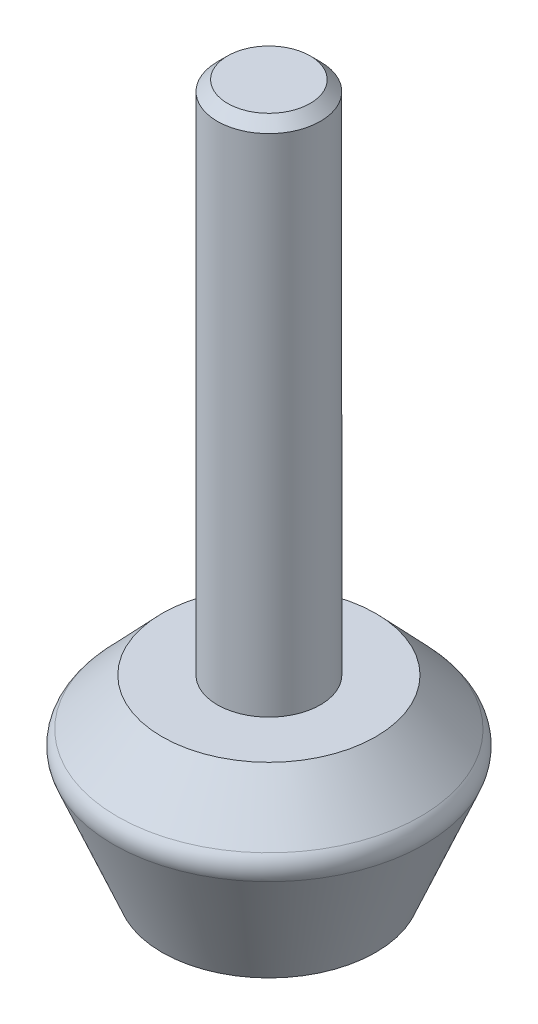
SolidWorks part; units mm, degrees
ref_plane "Frontal" through (0, 0, 0) normal (0, 0, 1) x (1, 0, 0)
ref_plane "Horizontal" through (0, 0, 0) normal (0, 1, 0) x (1, 0, 0)
ref_plane "Vertical" through (0, 0, 0) normal (1, 0, 0) x (0, 0, -1)
sketch "Esquisse1" plane through (0, 0, 0) normal (0, 0, 1) x (1, 0, 0)
  line L0 (0, 60.9391) -> (0, -10.3481) construction
  line L1 (0, 0) -> (5.1812, 0)
  line L2 (5.1812, 0) -> (7.7913, 6.3132)
  line L3 (7.7913, 6.3132) -> (5.1812, 9.055)
  line L4 (5.1812, 9.055) -> (2.5, 9.055)
  line L5 (2.5, 9.055) -> (2.5, 34.055)
  line L6 (2.5, 34.055) -> (0, 34.055)
  line L7 (0, 34.055) -> (0, 0)
  dimension "D1" = 5
  dimension "D2" = 25
revolve "Base-Révolution" add sketch "Esquisse1" angle 360 about L0
fillet "Congé1" radius 1
chamfer "Chanfrein1" distance 0.5 angle 45
